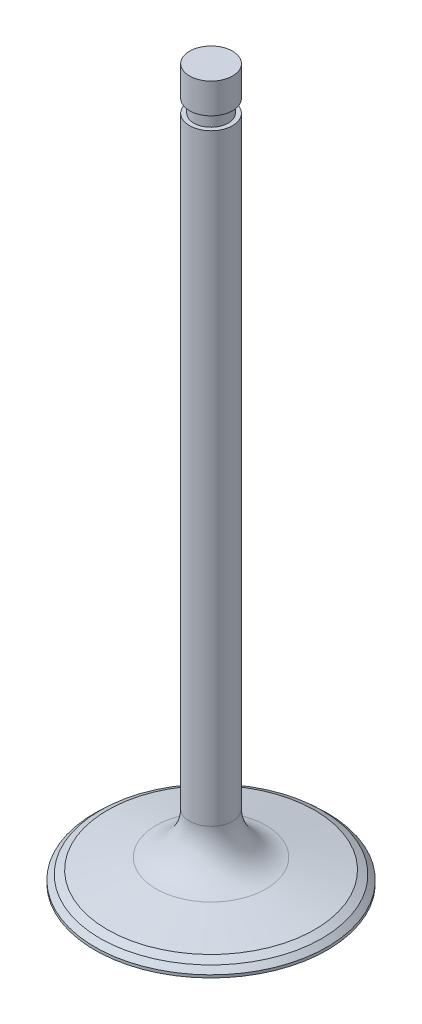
SolidWorks part; units mm, degrees
ref_plane "Front Plane" through (0, 0, 0) normal (0, 0, 1) x (1, 0, 0)
ref_plane "Top Plane" through (0, 0, 0) normal (0, 1, 0) x (1, 0, 0)
ref_plane "Right Plane" through (0, 0, 0) normal (1, 0, 0) x (0, 0, -1)
sketch "Sketch1" plane through (0, 0, 0) normal (0, 0, 1) x (1, 0, 0)
  line L0 (0, 0) -> (0, 165)
  line L1 (0, 0) -> (-27, 0)
  line L2 (-27, 0) -> (-27, 2)
  line L3 (-27, 2) -> (-5, 7)
  line L4 (-5, 7) -> (-5, 155)
  line L5 (-5, 165) -> (0, 165)
  line L6 (-5, 158) -> (-4, 158)
  line L7 (-4, 158) -> (-4, 155)
  line L8 (-4, 155) -> (-5, 155)
  line L9 (-5, 158) -> (-5, 165)
  dimension "D1" = 165
  dimension "D2" = 5
  dimension "D3" = 27
  dimension "D4" = 2
  dimension "D5" = 7
  dimension "D6" = 3
  dimension "D7" = 1
  dimension "D8" = 7
revolve "Revolve1" add sketch "Sketch1" angle 360 about L0
fillet "Fillet1" radius 10 1 edges at (0, 7, -5)
chamfer "Chamfer1" distance 2 angle 30 1 edges at (0, 2, -27)
chamfer "Chamfer3" distance 1 angle 15 1 edges at (0, 2.4432, 25.0497)
